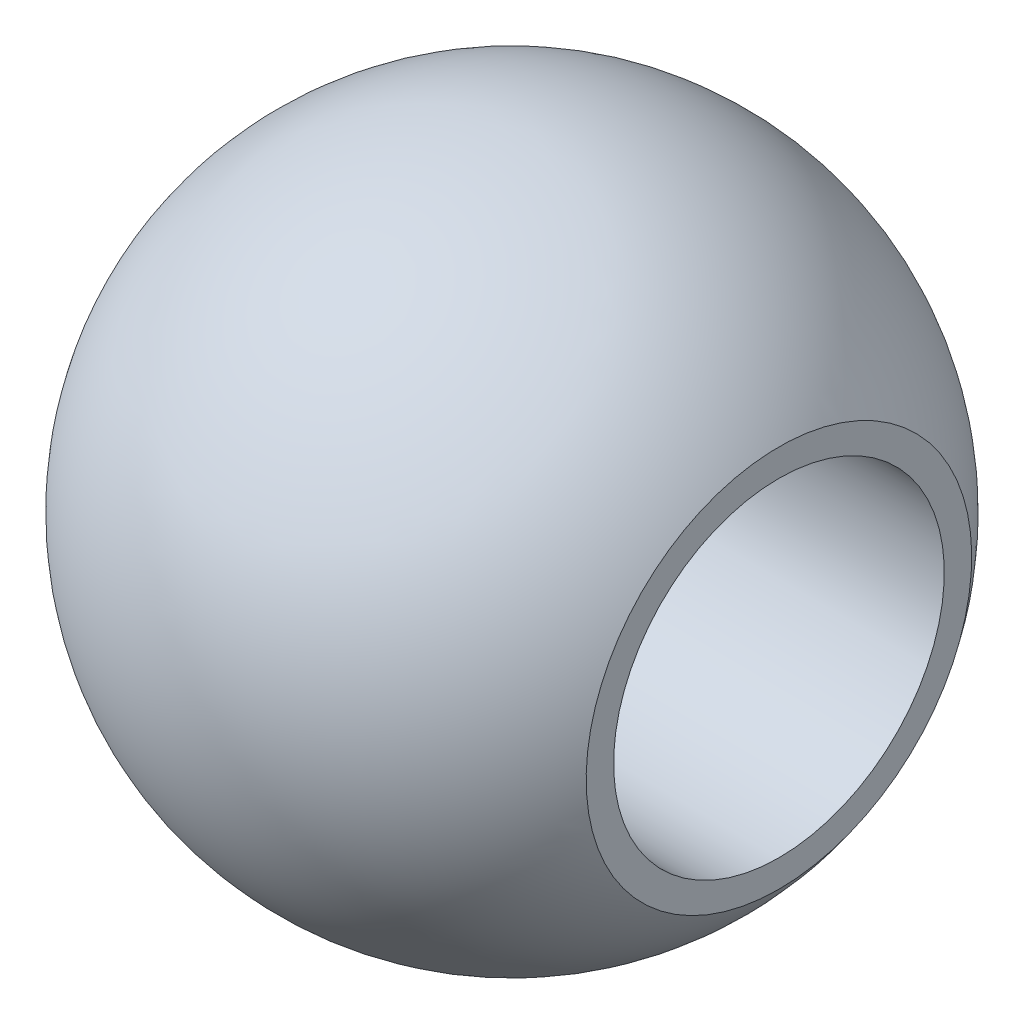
SolidWorks part; units mm, degrees
ref_plane "Plan de face" through (0, 0, 0) normal (0, 0, 1) x (1, 0, 0)
ref_plane "Plan de dessus" through (0, 0, 0) normal (0, 1, 0) x (1, 0, 0)
ref_plane "Plan de droite" through (0, 0, 0) normal (1, 0, 0) x (0, 0, -1)
sketch "Esquisse1" plane through (0, 0, 0) normal (0, 0, 1) x (1, 0, 0)
  line L1 (0, -55.2157) -> (0, 52.1595) construction
  line L2 (0, 8) -> (0, -8)
  arc A0 (0, -8) -> (0, 8) centre (0, 0) ccw
  dimension "D1" = 16
revolve "Révolution1" add sketch "Esquisse1" angle 360 about L1
ref_plane "Plan1" through (7.9999, -0.0251, 0.0251) normal (1, -0.0031, 0.0031) x (0.0031, 0, -1)
sketch "Esquisse2" plane through (7.9999, -0.0251, 0.0251) normal (1, -0.0031, 0.0031) x (0.0031, 0, -1)
  circle A0 centre (0, 0) radius 4
  dimension "D1" = 8
extrude "Enlèv. mat.-Extru.1" cut sketch "Esquisse2" against normal through all
sketch "Esquisse3" plane through (7.9999, -0.0251, 0.0251) normal (1, -0.0031, 0.0031) x (0.0031, 0, -1)
  line L1 (21.5594, 7.3252) -> (-8.9366, 7.3252)
  line L2 (21.5594, 7.3252) -> (21.5594, -10.377)
  line L3 (21.5594, -10.377) -> (-8.9366, -10.377)
  line L4 (-8.9366, 7.3252) -> (-8.9366, -10.377)
extrude "Enlèv. mat.-Extru.2" cut sketch "Esquisse3" against normal blind 1.5
ref_plane "Plan2" through (-11.9999, 0.0377, -0.0377) normal (1, -0.0031, 0.0031) x (0.0031, 0, -1)
sketch "Esquisse4" plane through (-11.9999, 0.0377, -0.0377) normal (1, -0.0031, 0.0031) x (0.0031, 0, -1)
  line L1 (14.3115, 7.5664) -> (-10.4059, 7.5664)
  line L2 (14.3115, 7.5664) -> (14.3115, -9.4898)
  line L3 (14.3115, -9.4898) -> (-10.4059, -9.4898)
  line L4 (-10.4059, 7.5664) -> (-10.4059, -9.4898)
extrude "Enlèv. mat.-Extru.3" cut sketch "Esquisse4" along normal blind 5.5
